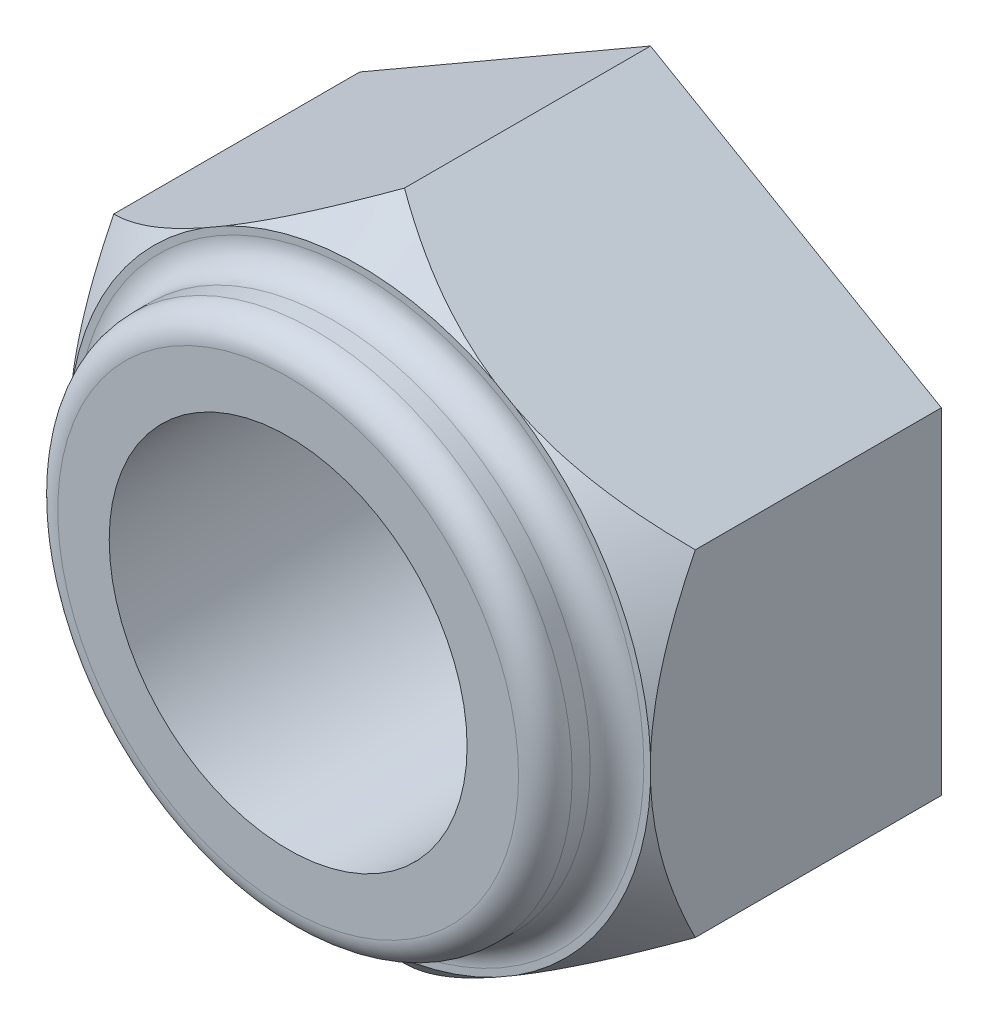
SolidWorks part; units mm, degrees
ref_plane "Face" through (0, 0, 0) normal (0, 0, 1) x (1, 0, 0)
ref_plane "Dessus" through (0, 0, 0) normal (0, 1, 0) x (1, 0, 0)
ref_plane "Droite" through (0, 0, 0) normal (1, 0, 0) x (0, 0, -1)
sketch "Esquisse1" plane through (0, 0, 0) normal (0, 0, 1) x (1, 0, 0)
  line L1 (0, 7.5056) -> (-6.5, 3.7528)
  line L2 (-6.5, 3.7528) -> (-6.5, -3.7528)
  line L3 (-6.5, -3.7528) -> (0, -7.5056)
  line L4 (0, -7.5056) -> (6.5, -3.7528)
  line L5 (6.5, -3.7528) -> (6.5, 3.7528)
  line L6 (6.5, 3.7528) -> (0, 7.5056)
  circle A0 centre (0, 0) radius 6.5 construction
  circle A1 centre (0, 0) radius 4
  dimension "D1" = 13
  dimension "D2" = 8
extrude "Base-Extrusion" add sketch "Esquisse1" against normal blind 6.5
sketch "Esquisse3" plane through (0, 0, 0) normal (0, 0, 1) x (1, 0, 0)
  circle A0 centre (0, 0) radius 4
  circle A1 centre (0, 0) radius 5.75
  circle A2 centre (0, 0) radius 4 construction
  dimension "D1" = 11.5
extrude "Extrusion1" add sketch "Esquisse3" along normal blind 1.6
fillet "Congé1" radius 0.6
sketch "Esquisse2" plane through (0, 0, 0) normal (1, 0, 0) x (0, 0, -1)
  line L0 (0, 7.5056) -> (1, 7.5056)
  line L1 (6.5, 7.5056) -> (0, 7.5056) construction
  line L2 (1, 7.5056) -> (0, 6.5056)
  line L3 (0, 3.7528) -> (0, 7.5056) construction
  line L4 (0, 6.5056) -> (0, 7.5056)
  line L9 (0, 0) -> (7.1553, 0) construction
  line L10 (6.5, 0) -> (-1.6, 0) construction
  dimension "D1" = 1
revolve "Enlèvement de matière-Révolution1" cut sketch "Esquisse2" angle 360 about L9
